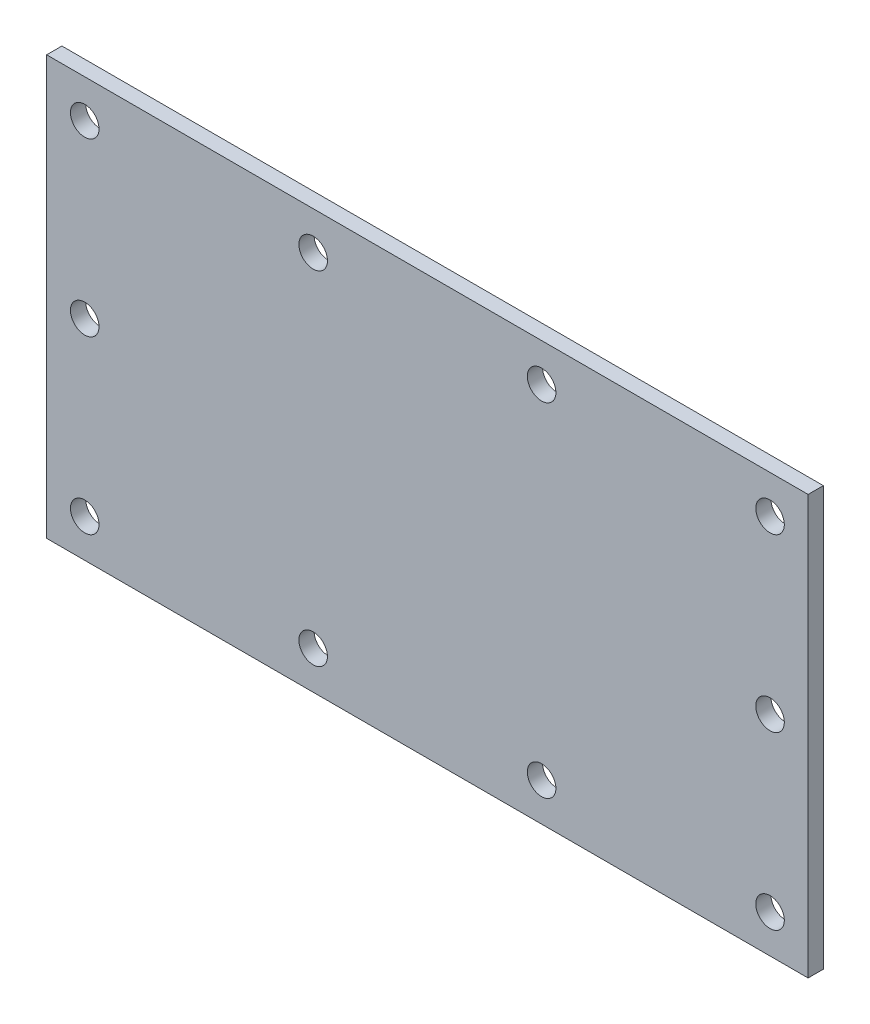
SolidWorks part; units mm, degrees
ref_plane "Face" through (0, 0, 0) normal (0, 0, 1) x (1, 0, 0)
ref_plane "Dessus" through (0, 0, 0) normal (0, 1, 0) x (1, 0, 0)
ref_plane "Droite" through (0, 0, 0) normal (1, 0, 0) x (0, 0, -1)
sketch "Esquisse1" plane through (0, 0, 0) normal (0, 0, 1) x (1, 0, 0)
  line L1 (0, 0) -> (400, 0)
  line L2 (0, 0) -> (0, -220)
  line L3 (0, -220) -> (400, -220)
  line L4 (400, 0) -> (400, -220)
  circle A0 centre (380, -20) radius 7.5
  circle A1 centre (380, -110) radius 7.5
  circle A2 centre (380, -200) radius 7.5
  circle A3 centre (260, -200) radius 7.5
  circle A4 centre (140, -200) radius 7.5
  circle A5 centre (20, -200) radius 7.5
  circle A6 centre (20, -110) radius 7.5
  circle A7 centre (20, -20) radius 7.5
  circle A8 centre (140, -20) radius 7.5
  circle A9 centre (260, -20) radius 7.5
  dimension "D3" = 15
  dimension "D1" = 400
  dimension "D2" = 220
  dimension "D4" = 20
  dimension "D5" = 110
  dimension "D6" = 200
  dimension "D7" = 20
  dimension "D8" = 140
  dimension "D9" = 260
  dimension "D10" = 380
extrude "Base-Extrusion" add sketch "Esquisse1" along normal blind 8
